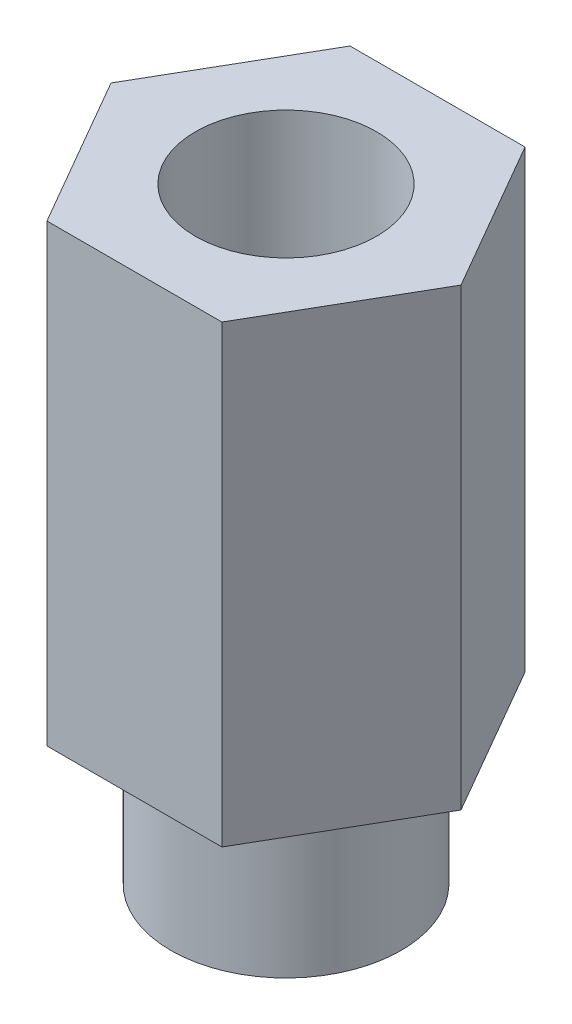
SolidWorks part; units mm, degrees
ref_plane "Front Plane" through (0, 0, 0) normal (0, 0, 1) x (1, 0, 0)
ref_plane "Top Plane" through (0, 0, 0) normal (0, 1, 0) x (1, 0, 0)
ref_plane "Right Plane" through (0, 0, 0) normal (1, 0, 0) x (0, 0, -1)
sketch "Sketch1" plane through (0, 0, 0) normal (0, 1, 0) x (1, 0, 0)
  circle A0 centre (0, 0) radius 2.413
  dimension "D1" = 4.826
extrude "Boss-Extrude1" add sketch "Sketch1" against normal blind 3.175
sketch "Sketch2" plane through (0, 0, 0) normal (0, 1, 0) x (1, 0, 0)
  line L1 (3.6662, 0) -> (1.8331, 3.175)
  line L2 (1.8331, 3.175) -> (-1.8331, 3.175)
  line L3 (-1.8331, 3.175) -> (-3.6662, 0)
  line L4 (-3.6662, 0) -> (-1.8331, -3.175)
  line L5 (-1.8331, -3.175) -> (1.8331, -3.175)
  line L6 (1.8331, -3.175) -> (3.6662, 0)
  circle A0 centre (0, 0) radius 3.175 construction
  dimension "D1" = 6.35
extrude "Boss-Extrude2" add sketch "Sketch2" along normal blind 9.525
hole_wizard "#10-24 Tapped Hole1" positions "Sketch4" profile "Sketch3" tap size "#10-24" standard "Ansi Inch"
sketch "Sketch4" plane through (0, 9.525, 0) normal (0, 1, 0) x (-1, 0, 0)
  point P0 (0, 0)
sketch "Sketch3" plane through (0, 9.525, 0) normal (1, 0, 0) x (0, 0, 1)
  line L0 (0, 0) -> (0, 10.6658)
  line L1 (0, 10.6658) -> (1.8986, 9.525)
  line L2 (1.8986, 9.525) -> (1.8986, 0)
  line L5 (1.8986, 0) -> (0, 0)
  line L10 (0, 10.6658) -> (-1.8987, 9.525) construction
  line L11 (0, -6.35) -> (0, 107.95) construction
  dimension "Tap Drill Dia." = 3.7973
  dimension "Tap Drill Depth" = 9.525
  dimension "Drill Angle" = 118
